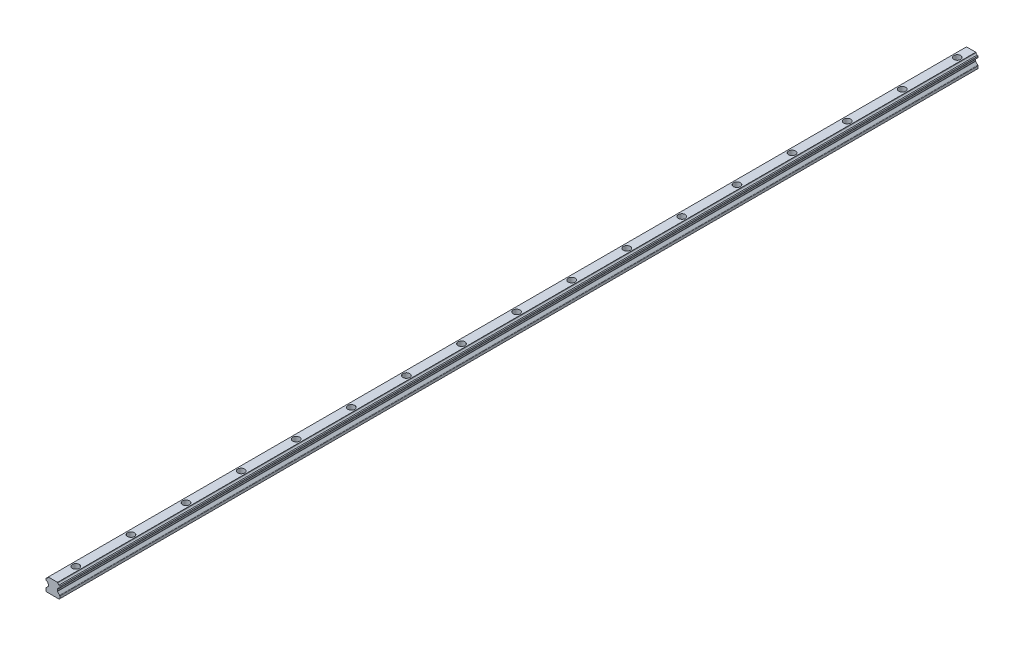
SolidWorks part; units mm, degrees
ref_plane "Front Plane" through (0, 0, 0) normal (0, 0, 1) x (1, 0, 0)
ref_plane "Top Plane" through (0, 0, 0) normal (0, 1, 0) x (1, 0, 0)
ref_plane "Right Plane" through (0, 0, 0) normal (1, 0, 0) x (0, 0, -1)
sketch "Sketch2" plane through (0, 0, 0) normal (0, 0, 1) x (1, 0, 0)
  line L0 (4.7543, 0.505) -> (4.9704, 0.721)
  line L1 (6.609, 2.3597) -> (7.3672, 3.1178)
  line L2 (7.3672, 3.1178) -> (7.3672, 4.6558)
  line L3 (7.3672, 4.6558) -> (6.5975, 5.4254)
  line L4 (4.972, 7.0509) -> (4.9162, 7.1068)
  line L5 (4.9162, 7.1068) -> (-5.1818, 7.1068)
  line L6 (-5.1818, 7.1068) -> (-5.2377, 7.0509)
  line L7 (-6.8632, 5.4254) -> (-7.6328, 4.6558)
  line L8 (-7.6328, 4.6558) -> (-7.6328, 3.1178)
  line L9 (-7.6328, 3.1178) -> (-6.8747, 2.3597)
  line L10 (-5.236, 0.721) -> (-5.02, 0.505)
  line L11 (-4.9028, 0.2221) -> (-4.9028, -1.3399)
  line L12 (-5.02, -1.6228) -> (-7.3399, -3.9427)
  line L13 (-7.6328, -4.6498) -> (-7.6328, -7.1932)
  line L14 (-7.6328, -7.1932) -> (-6.9328, -7.8932)
  line L15 (-6.9328, -7.8932) -> (6.6672, -7.8932)
  line L16 (6.6672, -7.8932) -> (7.3672, -7.1932)
  line L17 (7.3672, -7.1932) -> (7.3672, -4.6498)
  line L18 (7.0743, -3.9427) -> (4.7543, -1.6228)
  line L19 (4.6372, -1.3399) -> (4.6372, 0.2221)
  arc A0 (4.7543, 0.505) -> (4.6372, 0.2221) centre (5.0372, 0.2221) ccw
  arc A1 (4.9704, 0.721) -> (5.0841, 0.9519) centre (4.6875, 1.0039) ccw
  arc A2 (6.609, 2.3597) -> (5.0841, 0.9519) centre (6.6904, 0.7417) ccw
  arc A3 (5.0855, 6.8225) -> (6.5975, 5.4254) centre (6.6904, 7.0428) ccw
  arc A4 (5.0855, 6.8225) -> (4.972, 7.0509) centre (4.6892, 6.7681) ccw
  arc A5 (-5.2377, 7.0509) -> (-5.3512, 6.8225) centre (-4.9549, 6.7681) ccw
  arc A6 (-6.8632, 5.4254) -> (-5.3512, 6.8225) centre (-6.9561, 7.0428) ccw
  arc A7 (-5.3498, 0.9519) -> (-6.8747, 2.3597) centre (-6.9561, 0.7417) ccw
  arc A8 (-5.3498, 0.9519) -> (-5.236, 0.721) centre (-4.9532, 1.0039) ccw
  arc A9 (-4.9028, 0.2221) -> (-5.02, 0.505) centre (-5.3028, 0.2221) ccw
  arc A10 (-5.02, -1.6228) -> (-4.9028, -1.3399) centre (-5.3028, -1.3399) ccw
  arc A11 (-7.3399, -3.9427) -> (-7.6328, -4.6498) centre (-6.6328, -4.6498) ccw
  arc A12 (7.3672, -4.6498) -> (7.0743, -3.9427) centre (6.3672, -4.6498) ccw
  arc A13 (4.6372, -1.3399) -> (4.7543, -1.6228) centre (5.0372, -1.3399) ccw
extrude "Boss-Extrude1" add sketch "Sketch2" along normal blind 1000
sketch "Sketch4" plane through (0, 7.1068, 0) normal (0, 1, 0) x (1, 0, 0)
  line L0 (4.9162, 0) -> (-5.1818, 0) construction
  line L1 (7.3672, -1000) -> (7.3672, 0) construction
  point P0 (-0.1328, -15)
  dimension "D1" = 15
  dimension "D2" = 7.5
hole_wizard "CBORE for M16 Hex Head Bolt1" positions "Sketch4" profile "Sketch5" counterbore size "M16" standard "DIN"
sketch "Sketch5" plane through (-0.1328, 7.1068, 15) normal (1, 0, 0) x (0, 0, 1)
  line L0 (0, 0) -> (0, 15)
  line L1 (0, 15) -> (2.25, 15)
  line L3 (2.25, 15) -> (2.25, 5.3)
  line L4 (2.25, 5.3) -> (3.75, 5.3)
  line L5 (3.75, 5.3) -> (3.75, 0)
  line L7 (3.75, 0) -> (0, 0)
  line L11 (0, -6.35) -> (0, 107.95) construction
  dimension "Thru Hole Dia." = 4.5
  dimension "Thru Hole Depth" = 15
  dimension "C'Bore Dia." = 7.5
  dimension "C'Bore Depth" = 5.3
other "Fill Pattern1" parameters "D5"=0, "D6"=0, "D1"=60, "D2"=60, "D3"=0, "D9"=17, "D7"=17, "D8"=2
